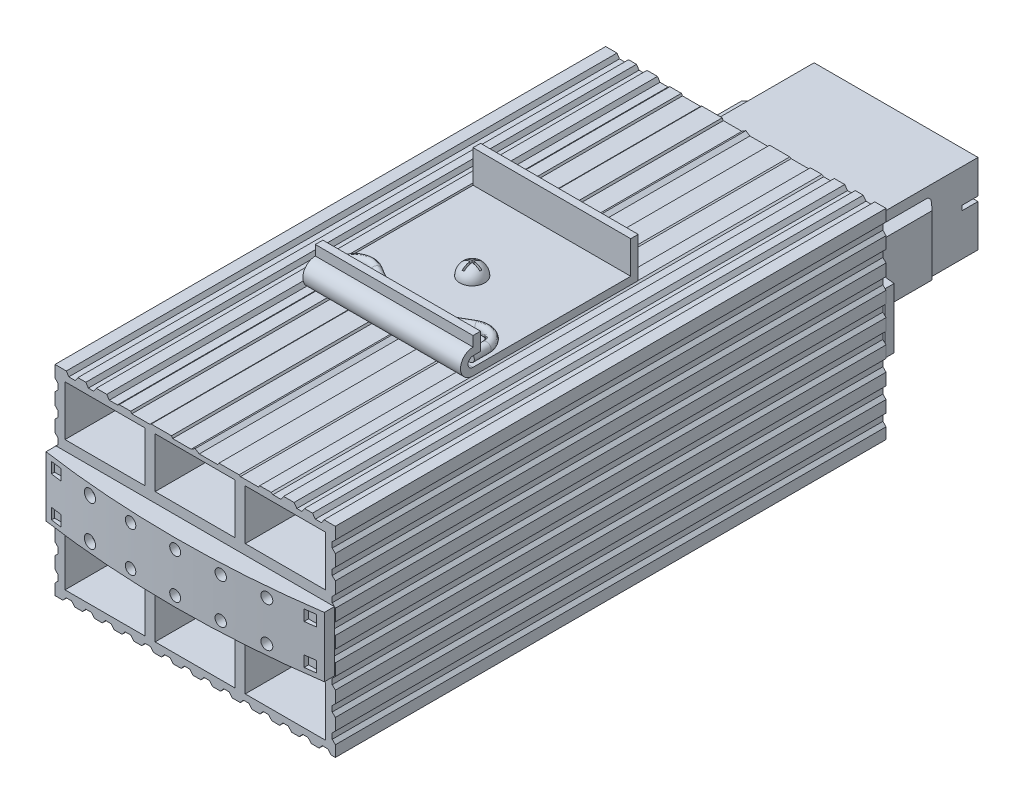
SolidWorks part; units mm, degrees
other "LUMP1"
ref_plane "Спереди" through (0, 0, 0) normal (0, 0, 1) x (1, 0, 0)
ref_plane "Сверху" through (0, 0, 0) normal (0, 1, 0) x (1, 0, 0)
ref_plane "Справа" through (0, 0, 0) normal (1, 0, 0) x (0, 0, -1)
imported_body "Импортированный1"
sketch "Эскиз1" plane through (0, 0, 139.7) normal (0, 0, 1) x (1, 0, 0)
  line L0 (-35.56, 22.4) -> (-34.76, 21.6)
  line L1 (-35.56, 25.4) -> (-35.56, -25.4) construction
  line L2 (-34.76, 21.6) -> (-34.76, 20.2)
  line L3 (-34.76, 20.2) -> (-35.56, 19.4)
  line L4 (-35.56, 19.4) -> (-36.4722, 19.4)
  line L5 (-36.4722, 19.4) -> (-36.4722, 22.4)
  line L6 (-36.4722, 22.4) -> (-35.56, 22.4)
  line L7 (35.56, 25.4) -> (-35.56, 25.4) construction
  line L8 (0, 25.4) -> (0, 18.4457) construction
  line L9 (-35.56, 16.4) -> (-34.76, 15.6)
  line L10 (-34.76, 15.6) -> (-34.76, 14.2)
  line L11 (-34.76, 14.2) -> (-35.56, 13.4)
  line L12 (-35.56, 13.4) -> (-36.4722, 13.4)
  line L13 (-36.4722, 13.4) -> (-36.4722, 16.4)
  line L14 (-36.4722, 16.4) -> (-35.56, 16.4)
  line L15 (-35.56, 10.4) -> (-34.76, 9.6)
  line L16 (-34.76, 9.6) -> (-34.76, 8.2)
  line L17 (-34.76, 8.2) -> (-35.56, 7.4)
  line L18 (-35.56, 7.4) -> (-36.4722, 7.4)
  line L19 (-36.4722, 7.4) -> (-36.4722, 10.4)
  line L20 (-36.4722, 10.4) -> (-35.56, 10.4)
  line L21 (-35.56, 4.4) -> (-34.76, 3.6)
  line L22 (-34.76, 3.6) -> (-34.76, 2.2)
  line L23 (-34.76, 2.2) -> (-35.56, 1.4)
  line L24 (-35.56, 1.4) -> (-36.4722, 1.4)
  line L25 (-36.4722, 1.4) -> (-36.4722, 4.4)
  line L26 (-36.4722, 4.4) -> (-35.56, 4.4)
  line L27 (-35.56, -1.6) -> (-34.76, -2.4)
  line L28 (-34.76, -2.4) -> (-34.76, -3.8)
  line L29 (-34.76, -3.8) -> (-35.56, -4.6)
  line L30 (-35.56, -4.6) -> (-36.4722, -4.6)
  line L31 (-36.4722, -4.6) -> (-36.4722, -1.6)
  line L32 (-36.4722, -1.6) -> (-35.56, -1.6)
  line L33 (-35.56, -7.6) -> (-34.76, -8.4)
  line L34 (-34.76, -8.4) -> (-34.76, -9.8)
  line L35 (-34.76, -9.8) -> (-35.56, -10.6)
  line L36 (-35.56, -10.6) -> (-36.4722, -10.6)
  line L37 (-36.4722, -10.6) -> (-36.4722, -7.6)
  line L38 (-36.4722, -7.6) -> (-35.56, -7.6)
  line L39 (-35.56, -13.6) -> (-34.76, -14.4)
  line L40 (-34.76, -14.4) -> (-34.76, -15.8)
  line L41 (-34.76, -15.8) -> (-35.56, -16.6)
  line L42 (-35.56, -16.6) -> (-36.4722, -16.6)
  line L43 (-36.4722, -16.6) -> (-36.4722, -13.6)
  line L44 (-36.4722, -13.6) -> (-35.56, -13.6)
  line L45 (-35.56, -19.6) -> (-34.76, -20.4)
  line L46 (-34.76, -20.4) -> (-34.76, -21.8)
  line L47 (-34.76, -21.8) -> (-35.56, -22.6)
  line L48 (-35.56, -22.6) -> (-36.4722, -22.6)
  line L49 (-36.4722, -22.6) -> (-36.4722, -19.6)
  line L50 (-36.4722, -19.6) -> (-35.56, -19.6)
  line L51 (36.4722, -19.6) -> (35.56, -19.6)
  line L52 (36.4722, -22.6) -> (36.4722, -19.6)
  line L53 (35.56, -22.6) -> (36.4722, -22.6)
  line L54 (34.76, -21.8) -> (35.56, -22.6)
  line L55 (34.76, -20.4) -> (34.76, -21.8)
  line L56 (35.56, -19.6) -> (34.76, -20.4)
  line L57 (36.4722, -13.6) -> (35.56, -13.6)
  line L58 (36.4722, -16.6) -> (36.4722, -13.6)
  line L59 (35.56, -16.6) -> (36.4722, -16.6)
  line L60 (34.76, -15.8) -> (35.56, -16.6)
  line L61 (34.76, -14.4) -> (34.76, -15.8)
  line L62 (35.56, -13.6) -> (34.76, -14.4)
  line L63 (36.4722, -7.6) -> (35.56, -7.6)
  line L64 (36.4722, -10.6) -> (36.4722, -7.6)
  line L65 (35.56, -10.6) -> (36.4722, -10.6)
  line L66 (34.76, -9.8) -> (35.56, -10.6)
  line L67 (34.76, -8.4) -> (34.76, -9.8)
  line L68 (35.56, -7.6) -> (34.76, -8.4)
  line L69 (36.4722, -1.6) -> (35.56, -1.6)
  line L70 (36.4722, -4.6) -> (36.4722, -1.6)
  line L71 (35.56, -4.6) -> (36.4722, -4.6)
  line L72 (34.76, -3.8) -> (35.56, -4.6)
  line L73 (34.76, -2.4) -> (34.76, -3.8)
  line L74 (35.56, -1.6) -> (34.76, -2.4)
  line L75 (36.4722, 4.4) -> (35.56, 4.4)
  line L76 (36.4722, 1.4) -> (36.4722, 4.4)
  line L77 (35.56, 1.4) -> (36.4722, 1.4)
  line L78 (34.76, 2.2) -> (35.56, 1.4)
  line L79 (34.76, 3.6) -> (34.76, 2.2)
  line L80 (35.56, 4.4) -> (34.76, 3.6)
  line L81 (36.4722, 10.4) -> (35.56, 10.4)
  line L82 (36.4722, 7.4) -> (36.4722, 10.4)
  line L83 (35.56, 7.4) -> (36.4722, 7.4)
  line L84 (34.76, 8.2) -> (35.56, 7.4)
  line L85 (34.76, 9.6) -> (34.76, 8.2)
  line L86 (35.56, 10.4) -> (34.76, 9.6)
  line L87 (36.4722, 16.4) -> (35.56, 16.4)
  line L88 (36.4722, 13.4) -> (36.4722, 16.4)
  line L89 (35.56, 13.4) -> (36.4722, 13.4)
  line L90 (34.76, 14.2) -> (35.56, 13.4)
  line L91 (34.76, 15.6) -> (34.76, 14.2)
  line L92 (35.56, 16.4) -> (34.76, 15.6)
  line L93 (36.4722, 22.4) -> (35.56, 22.4)
  line L94 (36.4722, 19.4) -> (36.4722, 22.4)
  line L95 (35.56, 19.4) -> (36.4722, 19.4)
  line L96 (34.76, 20.2) -> (35.56, 19.4)
  line L97 (34.76, 21.6) -> (34.76, 20.2)
  line L98 (35.56, 22.4) -> (34.76, 21.6)
  dimension "D1" = 3
  dimension "D2" = 1.4
  dimension "D3" = 0.8
  dimension "D4" = 3
  dimension "D5" = 8
extrude "Вырез-Вытянуть1" cut sketch "Эскиз1" against normal up to surface (139.7 mm away)
sketch "Эскиз2" plane through (0, 0, 139.7) normal (0, 0, 1) x (1, 0, 0)
  line L0 (-33.56, -25.4) -> (-32.76, -24.458)
  line L1 (-35.56, -25.4) -> (35.56, -25.4) construction
  line L2 (-32.76, -24.458) -> (-31.36, -24.458)
  line L3 (-31.36, -24.458) -> (-30.56, -25.4)
  line L4 (-30.56, -25.4) -> (-30.56, -26.268)
  line L5 (-30.56, -26.268) -> (-33.56, -26.268)
  line L6 (-33.56, -26.268) -> (-33.56, -25.4)
  line L7 (-35.56, -22.6) -> (-35.56, -25.4) construction
  line L8 (-28.56, -25.4) -> (-27.76, -24.458)
  line L9 (-27.76, -24.458) -> (-26.36, -24.458)
  line L10 (-26.36, -24.458) -> (-25.56, -25.4)
  line L11 (-25.56, -25.4) -> (-25.56, -26.268)
  line L12 (-25.56, -26.268) -> (-28.56, -26.268)
  line L13 (-28.56, -26.268) -> (-28.56, -25.4)
  line L14 (-23.56, -25.4) -> (-22.76, -24.458)
  line L15 (-22.76, -24.458) -> (-21.36, -24.458)
  line L16 (-21.36, -24.458) -> (-20.56, -25.4)
  line L17 (-20.56, -25.4) -> (-20.56, -26.268)
  line L18 (-20.56, -26.268) -> (-23.56, -26.268)
  line L19 (-23.56, -26.268) -> (-23.56, -25.4)
  line L20 (-18.56, -25.4) -> (-17.76, -24.458)
  line L21 (-17.76, -24.458) -> (-16.36, -24.458)
  line L22 (-16.36, -24.458) -> (-15.56, -25.4)
  line L23 (-15.56, -25.4) -> (-15.56, -26.268)
  line L24 (-15.56, -26.268) -> (-18.56, -26.268)
  line L25 (-18.56, -26.268) -> (-18.56, -25.4)
  line L26 (-13.56, -25.4) -> (-12.76, -24.458)
  line L27 (-12.76, -24.458) -> (-11.36, -24.458)
  line L28 (-11.36, -24.458) -> (-10.56, -25.4)
  line L29 (-10.56, -25.4) -> (-10.56, -26.268)
  line L30 (-10.56, -26.268) -> (-13.56, -26.268)
  line L31 (-13.56, -26.268) -> (-13.56, -25.4)
  line L32 (-8.56, -25.4) -> (-7.76, -24.458)
  line L33 (-7.76, -24.458) -> (-6.36, -24.458)
  line L34 (-6.36, -24.458) -> (-5.56, -25.4)
  line L35 (-5.56, -25.4) -> (-5.56, -26.268)
  line L36 (-5.56, -26.268) -> (-8.56, -26.268)
  line L37 (-8.56, -26.268) -> (-8.56, -25.4)
  line L38 (-3.56, -25.4) -> (-2.76, -24.458)
  line L39 (-2.76, -24.458) -> (-1.36, -24.458)
  line L40 (-1.36, -24.458) -> (-0.56, -25.4)
  line L41 (-0.56, -25.4) -> (-0.56, -26.268)
  line L42 (-0.56, -26.268) -> (-3.56, -26.268)
  line L43 (-3.56, -26.268) -> (-3.56, -25.4)
  line L44 (1.44, -25.4) -> (2.24, -24.458)
  line L45 (2.24, -24.458) -> (3.64, -24.458)
  line L46 (3.64, -24.458) -> (4.44, -25.4)
  line L47 (4.44, -25.4) -> (4.44, -26.268)
  line L48 (4.44, -26.268) -> (1.44, -26.268)
  line L49 (1.44, -26.268) -> (1.44, -25.4)
  line L50 (6.44, -25.4) -> (7.24, -24.458)
  line L51 (7.24, -24.458) -> (8.64, -24.458)
  line L52 (8.64, -24.458) -> (9.44, -25.4)
  line L53 (9.44, -25.4) -> (9.44, -26.268)
  line L54 (9.44, -26.268) -> (6.44, -26.268)
  line L55 (6.44, -26.268) -> (6.44, -25.4)
  line L56 (11.44, -25.4) -> (12.24, -24.458)
  line L57 (12.24, -24.458) -> (13.64, -24.458)
  line L58 (13.64, -24.458) -> (14.44, -25.4)
  line L59 (14.44, -25.4) -> (14.44, -26.268)
  line L60 (14.44, -26.268) -> (11.44, -26.268)
  line L61 (11.44, -26.268) -> (11.44, -25.4)
  line L62 (16.44, -25.4) -> (17.24, -24.458)
  line L63 (17.24, -24.458) -> (18.64, -24.458)
  line L64 (18.64, -24.458) -> (19.44, -25.4)
  line L65 (19.44, -25.4) -> (19.44, -26.268)
  line L66 (19.44, -26.268) -> (16.44, -26.268)
  line L67 (16.44, -26.268) -> (16.44, -25.4)
  line L68 (21.44, -25.4) -> (22.24, -24.458)
  line L69 (22.24, -24.458) -> (23.64, -24.458)
  line L70 (23.64, -24.458) -> (24.44, -25.4)
  line L71 (24.44, -25.4) -> (24.44, -26.268)
  line L72 (24.44, -26.268) -> (21.44, -26.268)
  line L73 (21.44, -26.268) -> (21.44, -25.4)
  line L74 (26.44, -25.4) -> (27.24, -24.458)
  line L75 (27.24, -24.458) -> (28.64, -24.458)
  line L76 (28.64, -24.458) -> (29.44, -25.4)
  line L77 (29.44, -25.4) -> (29.44, -26.268)
  line L78 (29.44, -26.268) -> (26.44, -26.268)
  line L79 (26.44, -26.268) -> (26.44, -25.4)
  line L80 (31.44, -25.4) -> (32.24, -24.458)
  line L81 (32.24, -24.458) -> (33.64, -24.458)
  line L82 (33.64, -24.458) -> (34.44, -25.4)
  line L83 (34.44, -25.4) -> (34.44, -26.268)
  line L84 (34.44, -26.268) -> (31.44, -26.268)
  line L85 (31.44, -26.268) -> (31.44, -25.4)
  dimension "D1" = 3
  dimension "D2" = 1.4
  dimension "D3" = 0.8
  dimension "D4" = 2
  dimension "D5" = 14
extrude "Вырез-Вытянуть2" cut sketch "Эскиз2" against normal up to surface (139.7 mm away)
sketch "Эскиз3" plane through (0, 0, 139.7) normal (0, 0, 1) x (1, 0, 0)
  line L0 (0, 26.3484) -> (0, 18.8696) construction
  line L1 (-32.6919, 25.4) -> (-32.0578, 24.4207)
  line L2 (35.56, 25.4) -> (-35.56, 25.4) construction
  line L3 (-32.0578, 24.4207) -> (-30.4726, 24.4207)
  line L4 (-30.4726, 24.4207) -> (-29.7592, 25.4)
  line L5 (-29.7592, 25.4) -> (-27.738, 25.4)
  line L6 (-27.738, 25.4) -> (-27.1038, 24.4207)
  line L7 (-27.1038, 24.4207) -> (-25.796, 24.4207)
  line L8 (-25.796, 24.4207) -> (-25.0826, 25.4)
  line L9 (-25.0826, 25.4) -> (-22.4273, 25.4)
  line L10 (-22.4273, 25.4) -> (-21.7932, 24.4207)
  line L11 (-21.7932, 24.4207) -> (-19.7323, 24.4207)
  line L12 (-19.7323, 24.4207) -> (-19.2723, 24.7186)
  line L13 (-19.2723, 24.7186) -> (-16.3636, 24.7186)
  line L14 (-16.3636, 24.7186) -> (-16.0808, 24.2819)
  line L15 (-16.0808, 24.2819) -> (-11.4889, 24.2819)
  line L16 (-11.4889, 24.2819) -> (-11.1517, 24.5003)
  line L17 (-11.1517, 24.5003) -> (-6.0197, 24.5003)
  line L18 (-6.0197, 24.5003) -> (-5.7163, 24.0318)
  line L19 (-5.7163, 24.0318) -> (-1.0261, 24.0318)
  line L20 (-1.0261, 24.0318) -> (-0.6643, 24.266)
  line L21 (-0.6643, 24.266) -> (0, 24.6962)
  line L22 (-32.6919, 25.4) -> (-32.6919, 26.3484)
  line L23 (-32.6919, 26.3484) -> (-20.0025, 26.3484)
  line L24 (-20.0025, 31.75) -> (-20.0025, 25.4) construction
  line L25 (-20.0025, 26.3484) -> (-20.0025, 25.4)
  line L26 (20.0025, 26.3484) -> (20.0025, 25.4)
  line L27 (32.6919, 26.3484) -> (20.0025, 26.3484)
  line L28 (32.6919, 25.4) -> (32.6919, 26.3484)
  line L29 (0.6643, 24.266) -> (0, 24.6962)
  line L30 (1.0261, 24.0318) -> (0.6643, 24.266)
  line L31 (5.7163, 24.0318) -> (1.0261, 24.0318)
  line L32 (6.0197, 24.5003) -> (5.7163, 24.0318)
  line L33 (11.1517, 24.5003) -> (6.0197, 24.5003)
  line L34 (11.4889, 24.2819) -> (11.1517, 24.5003)
  line L35 (16.0808, 24.2819) -> (11.4889, 24.2819)
  line L36 (16.3636, 24.7186) -> (16.0808, 24.2819)
  line L37 (19.2723, 24.7186) -> (16.3636, 24.7186)
  line L38 (19.7323, 24.4207) -> (19.2723, 24.7186)
  line L39 (21.7932, 24.4207) -> (19.7323, 24.4207)
  line L40 (22.4273, 25.4) -> (21.7932, 24.4207)
  line L41 (25.0826, 25.4) -> (22.4273, 25.4)
  line L42 (25.796, 24.4207) -> (25.0826, 25.4)
  line L43 (27.1038, 24.4207) -> (25.796, 24.4207)
  line L44 (27.738, 25.4) -> (27.1038, 24.4207)
  line L45 (29.7592, 25.4) -> (27.738, 25.4)
  line L46 (30.4726, 24.4207) -> (29.7592, 25.4)
  line L47 (32.0578, 24.4207) -> (30.4726, 24.4207)
  line L48 (32.6919, 25.4) -> (32.0578, 24.4207)
  line L49 (-20.0025, 25.4) -> (20.0025, 25.4)
extrude "Вырез-Вытянуть3" cut sketch "Эскиз3" against normal up to surface (139.7 mm away)
ref_plane "Плоскость1" through (0, 0, 145.7) normal (0, 0, 1) x (1, 0, 0)
sketch "Эскиз4" plane through (0, 0, 145.7) normal (0, 0, 1) x (1, 0, 0)
  line L0 (0, 0) -> (5.2597, 0) construction
  line L1 (-33.6904, 6.4372) -> (-30.9184, 6.4372)
  line L2 (-33.6904, 6.4372) -> (-33.6904, 3.6652)
  line L3 (-33.6904, 3.6652) -> (-30.9184, 3.6652)
  line L4 (-30.9184, 6.4372) -> (-30.9184, 3.6652)
  line L5 (33.5482, 6.4372) -> (30.7762, 6.4372)
  line L6 (33.5482, 6.4372) -> (33.5482, 3.6652)
  line L7 (33.5482, 3.6652) -> (30.7762, 3.6652)
  line L8 (30.7762, 6.4372) -> (30.7762, 3.6652)
  line L9 (30.7762, -6.4372) -> (30.7762, -3.6652)
  line L10 (33.5482, -3.6652) -> (30.7762, -3.6652)
  line L11 (33.5482, -6.4372) -> (33.5482, -3.6652)
  line L12 (33.5482, -6.4372) -> (30.7762, -6.4372)
  line L13 (-30.9184, -6.4372) -> (-30.9184, -3.6652)
  line L14 (-33.6904, -3.6652) -> (-30.9184, -3.6652)
  line L15 (-33.6904, -6.4372) -> (-33.6904, -3.6652)
  line L16 (-33.6904, -6.4372) -> (-30.9184, -6.4372)
  circle A0 centre (-22.6735, 5.0512) radius 1.5576
  circle A1 centre (-11.5855, 5.0512) radius 1.386
  circle A2 centre (0, 5.0512) radius 1.386
  circle A3 centre (11.3012, 5.0512) radius 1.386
  circle A4 centre (22.247, 5.0512) radius 1.386
  circle A5 centre (22.247, -5.0512) radius 1.386
  circle A6 centre (11.3012, -5.0512) radius 1.386
  circle A7 centre (0, -5.0512) radius 1.386
  circle A8 centre (-11.5855, -5.0512) radius 1.386
  circle A9 centre (-22.6735, -5.0512) radius 1.5576
extrude "Вырез-Вытянуть4" cut sketch "Эскиз4" against normal blind 4
sketch "Эскиз5" plane through (0, -11.684, 0) normal (0, -1, 0) x (1, 0, 0)
  circle A0 centre (-12.5908, -33.02) radius 2.0132
extrude "Вырез-Вытянуть5" cut sketch "Эскиз5" against normal blind 0.5
sketch "Эскиз6" plane through (0, -11.184, 0) normal (0, -1, 0) x (1, 0, 0)
  line L0 (-12.5908, -31.0068) -> (-12.5908, -35.0332) construction
  line L2 (-13.5908, -33.789) -> (-11.5908, -33.789)
  line L3 (-13.5908, -33.789) -> (-13.5908, -34.029)
  line L4 (-13.5908, -34.029) -> (-11.5908, -34.029)
  line L5 (-11.5908, -33.789) -> (-11.5908, -34.029)
  line L6 (-13.8908, -33.249) -> (-11.2908, -33.249)
  line L7 (-13.8908, -33.249) -> (-13.8908, -33.489)
  line L8 (-13.8908, -33.489) -> (-11.2908, -33.489)
  line L9 (-11.2908, -33.249) -> (-11.2908, -33.489)
  line L10 (-14.0382, -32.709) -> (-12.7108, -32.709)
  line L11 (-14.0382, -32.709) -> (-14.0382, -32.949)
  line L12 (-14.0382, -32.949) -> (-11.1248, -32.949)
  line L13 (-11.1248, -32.709) -> (-11.1248, -32.949)
  line L14 (-12.7108, -31.2596) -> (-12.4708, -31.2596)
  line L15 (-12.7108, -31.2596) -> (-12.7108, -32.709)
  line L17 (-12.4708, -31.2596) -> (-12.4708, -32.709)
  line L18 (-12.4708, -32.709) -> (-11.1248, -32.709)
  circle A0 centre (-12.5908, -33.02) radius 2.0132 construction
  circle A1 centre (-12.5908, -33.02) radius 2.0132 construction
  dimension "D1" = 0.24
  dimension "D2" = 1
  dimension "D3" = 2
  dimension "D4" = 0.24
  dimension "D5" = 1.3
  dimension "D6" = 2.6
  dimension "D7" = 0.24
  dimension "D8" = 0.12
  dimension "D9" = 0.24
  dimension "D10" = 0.3
  dimension "D11" = 0.3
extrude "Бобышка-Вытянуть1" add sketch "Эскиз6" along normal blind 0.6
sketch "Эскиз7" plane through (0, -11.684, 0) normal (0, -1, 0) x (1, 0, 0)
  circle A0 centre (-0.0025, -33.02) radius 2.0398
extrude "Вырез-Вытянуть6" cut sketch "Эскиз7" against normal blind 0.5
sketch "Эскиз8" plane through (0, -11.184, 0) normal (0, -1, 0) x (1, 0, 0)
  line L0 (-0.542, -31.3303) -> (-0.542, -34.008)
  line L1 (-0.542, -34.008) -> (1.2756, -34.008)
  line L2 (1.2756, -34.008) -> (1.2756, -34.248)
  line L3 (1.2756, -34.248) -> (-0.782, -34.248)
  line L4 (-0.782, -34.248) -> (-0.782, -31.3303)
  line L5 (-0.782, -31.3303) -> (-0.542, -31.3303)
  dimension "D1" = 0.24
  dimension "D2" = 0.24
extrude "Бобышка-Вытянуть2" add sketch "Эскиз8" along normal blind 0.6
sketch "Эскиз9" plane through (0, -11.684, 0) normal (0, -1, 0) x (1, 0, 0)
  circle A0 centre (12.5857, -33.02) radius 2.0229
extrude "Вырез-Вытянуть7" cut sketch "Эскиз9" against normal blind 0.6
sketch "Эскиз10" plane through (0, -11.084, 0) normal (0, -1, 0) x (1, 0, 0)
  line L0 (13.7431, -31.5917) -> (13.7431, -34.3518)
  line L1 (13.7431, -34.3518) -> (13.479, -34.3518)
  line L2 (13.479, -34.3518) -> (11.6964, -31.9271)
  line L3 (11.6964, -31.9271) -> (11.6964, -34.3518)
  line L4 (11.6964, -34.3518) -> (11.4564, -34.3518)
  line L5 (11.4564, -34.3518) -> (11.4564, -31.5547)
  line L6 (11.4564, -31.5547) -> (11.7206, -31.5547)
  line L7 (11.7206, -31.5547) -> (13.5031, -33.9794)
  line L8 (13.5031, -33.9794) -> (13.5031, -31.5917)
  line L9 (13.5031, -31.5917) -> (13.7431, -31.5917)
  dimension "D1" = 0.24
  dimension "D2" = 0.24
  dimension "D3" = 0.24
extrude "Бобышка-Вытянуть3" add sketch "Эскиз10" along normal blind 0.6
sketch "Эскиз11" plane through (0, 0, -38.1) normal (0, 0, -1) x (-1, 0, 0)
  line L0 (20.7892, -7.62) -> (20.7892, 7.62) construction
  line L1 (20.7892, 0.4731) -> (-20.7892, 0.4731)
  line L2 (20.7892, 0.4731) -> (20.7892, 1.6661)
  line L3 (20.7892, 1.6661) -> (-20.7892, 1.6661)
  line L4 (-20.7892, 0.4731) -> (-20.7892, 1.6661)
  line L5 (-20.7892, -10.16) -> (-20.7892, 10.16) construction
extrude "Вырез-Вытянуть8" cut sketch "Эскиз11" against normal blind 4
sketch "Эскиз12" plane through (0, -10.16, 0) normal (0, -1, 0) x (1, 0, 0)
  line L0 (-18.2499, -30.48) -> (-18.2499, -35.56) construction
  line L1 (-19.1499, -8.1129) -> (-18.5499, -8.1129)
  line L2 (-19.1499, -8.1129) -> (-19.1499, -36.2162)
  line L4 (-18.5499, -8.1129) -> (-18.5499, -35.7896)
  line L5 (-6.5617, -8.1129) -> (-5.9617, -8.1129)
  line L6 (-6.5617, -8.1129) -> (-6.5617, -35.7896)
  line L8 (-5.9617, -8.1129) -> (-5.9617, -35.7896)
  line L9 (6.6266, -8.1129) -> (6.0266, -8.1129)
  line L10 (6.6266, -8.1129) -> (6.6266, -35.7855)
  line L12 (6.0266, -8.1129) -> (6.0266, -35.7896)
  line L15 (18.5448, -8.1129) -> (19.1448, -8.1129)
  line L16 (19.1448, -36.2162) -> (19.1448, -8.1129)
  line L17 (-5.6617, -30.48) -> (-5.6617, -35.56) construction
  line L18 (6.9266, -35.56) -> (6.9266, -30.48) construction
  line L21 (-19.1499, -36.2162) -> (19.1448, -36.2162)
  line L26 (-5.9617, -35.7896) -> (6.0266, -35.7896)
  line L29 (-18.5499, -35.7896) -> (-6.5617, -35.7896)
  line L30 (6.6266, -35.7855) -> (18.5448, -35.7855)
  line L34 (18.5448, -35.7855) -> (18.5448, -8.1129)
  dimension "D1" = 0.6
  dimension "D2" = 0.3
  dimension "D3" = 0.6
  dimension "D4" = 0.3
  dimension "D5" = 0.6
  dimension "D6" = 0.3
extrude "Вырез-Вытянуть9" cut sketch "Эскиз12" against normal blind 1
ref_plane "Плоскость2" through (0, 0, -6) normal (0, 0, -1) x (-1, 0, 0)
sketch "Эскиз13" plane through (0, 0, -6) normal (0, 0, -1) x (-1, 0, 0)
  line L1 (-33.9569, 6.3727) -> (-31.232, 6.3727)
  line L2 (-33.9569, 6.3727) -> (-33.9569, 3.508)
  line L3 (-33.9569, 3.508) -> (-31.232, 3.508)
  line L4 (-31.232, 6.3727) -> (-31.232, 3.508)
  line L5 (30.7429, 6.3727) -> (33.5377, 6.3727)
  line L6 (30.7429, 6.3727) -> (30.7429, 3.508)
  line L7 (30.7429, 3.508) -> (33.5377, 3.508)
  line L8 (33.5377, 6.3727) -> (33.5377, 3.508)
  line L9 (33.5377, -6.0642) -> (30.7429, -6.0642)
  line L10 (33.5377, -6.0642) -> (33.5377, -2.8502)
  line L11 (33.5377, -2.8502) -> (30.7429, -2.8502)
  line L12 (30.7429, -6.0642) -> (30.7429, -2.8502)
  line L13 (-31.232, -6.0642) -> (-33.9569, -6.0642)
  line L14 (-31.232, -6.0642) -> (-31.232, -2.8502)
  line L15 (-31.232, -2.8502) -> (-33.9569, -2.8502)
  line L16 (-33.9569, -6.0642) -> (-33.9569, -2.8502)
extrude "Вырез-Вытянуть10" cut sketch "Эскиз13" against normal blind 4
ref_plane "Плоскость3" through (0, 28.555, 0) normal (0, 1, 0) x (1, 0, 0)
sketch "Эскиз14" plane through (0, 28.555, 0) normal (0, 1, 0) x (1, 0, 0)
  line L0 (-18.4875, -90.3108) -> (-18.4875, -84.0764)
  line L1 (-12.1845, -81.5701) -> (-1.1719, -87.9283)
  line L2 (-20.0025, -87.3125) -> (20.0025, -87.3125) construction
  arc A0 (-18.4875, -84.0764) -> (-12.1845, -81.5701) centre (-14.6245, -84.6125) cw
  dimension "D2" = 3.9
  dimension "D1" = 2.7
  dimension "D3" = 60
ref_plane "Плоскость4" through (0, 0, 88.5625) normal (0, 0, -1) x (-1, 0, 0)
sketch "Эскиз15" plane through (0, 0, 88.5625) normal (0, 0, -1) x (-1, 0, 0)
  line L0 (18.4875, 28.555) -> (12.1845, 28.555) construction
  circle A0 centre (18.4875, 28.555) radius 1.1514
sweep "По траектории1" add profiles "Эскиз15" path "Эскиз14"
sketch "Эскиз16" plane through (0, 28.555, 0) normal (0, 1, 0) x (1, 0, 0)
  line L0 (18.6094, -89.5898) -> (18.6094, -84.3099)
  line L1 (12.7646, -81.135) -> (1.3619, -87.7184)
  line L2 (-20.0025, -87.3125) -> (20.0025, -87.3125) construction
  arc A0 (18.6094, -84.3099) -> (12.7646, -81.135) centre (14.7146, -84.5125) ccw
  dimension "D2" = 3.9
  dimension "D1" = 2.8
  dimension "D3" = 60
sketch "Эскиз17" plane through (0, 0, 88.5625) normal (0, 0, -1) x (-1, 0, 0)
  line L0 (-12.7646, 28.555) -> (-18.6094, 28.555) construction
  circle A0 centre (-18.4828, 28.555) radius 1.1931
sweep "По траектории2" add profiles "Эскиз17" path "Эскиз16"
sketch "Эскиз18" plane through (0, 27.305, 0) normal (0, 1, 0) x (1, 0, 0)
  line L0 (-20.0025, -69.215) -> (20.0025, -69.215) construction
  line L1 (-20.0025, -89.2175) -> (-20.0025, -49.2125) construction
  line L2 (20.0025, -89.2175) -> (20.0025, -49.2125) construction
  line L3 (-3.3605, -69.215) -> (2.9512, -69.215)
  arc A0 (-3.3605, -69.215) -> (2.9512, -69.215) centre (-0.2047, -69.215) cw
revolve "Повернуть1" add sketch "Эскиз18" angle 180 about L0
ref_plane "Плоскость5" through (0, 32.305, 0) normal (0, 1, 0) x (1, 0, 0)
sketch "Эскиз19" plane through (0, 32.305, 0) normal (0, 1, 0) x (1, 0, 0)
  line L0 (-0.25, -66.0595) -> (-0.25, -72.3705) construction
  line L1 (-3.3605, -69.215) -> (2.9512, -69.215) construction
  line L2 (-0.5, -66.965) -> (0, -66.965)
  line L3 (0, -66.965) -> (0, -68.965)
  line L4 (0, -68.965) -> (2, -68.965)
  line L5 (2, -68.965) -> (2, -69.465)
  line L6 (2, -69.465) -> (0, -69.465)
  line L7 (0, -69.465) -> (0, -71.465)
  line L8 (0, -71.465) -> (-0.5, -71.465)
  line L9 (-0.5, -71.465) -> (-0.5, -69.465)
  line L10 (-0.5, -69.465) -> (-2.5, -69.465)
  line L11 (-2.5, -69.465) -> (-2.5, -68.965)
  line L12 (-2.5, -68.965) -> (-0.5, -68.965)
  line L13 (-0.5, -68.965) -> (-0.5, -66.965)
  circle A0 centre (-0.2047, -69.215) radius 3.1558 construction
  dimension "D1" = 0.25
  dimension "D2" = 0.25
  dimension "D3" = 0.25
  dimension "D4" = 0.25
  dimension "D5" = 0.25
  dimension "D6" = 0.25
  dimension "D7" = 0.25
  dimension "D8" = 2
  dimension "D9" = 2
  dimension "D10" = 2
  dimension "D11" = 2
extrude "Вырез-Вытянуть11" cut sketch "Эскиз19" against normal blind 4
